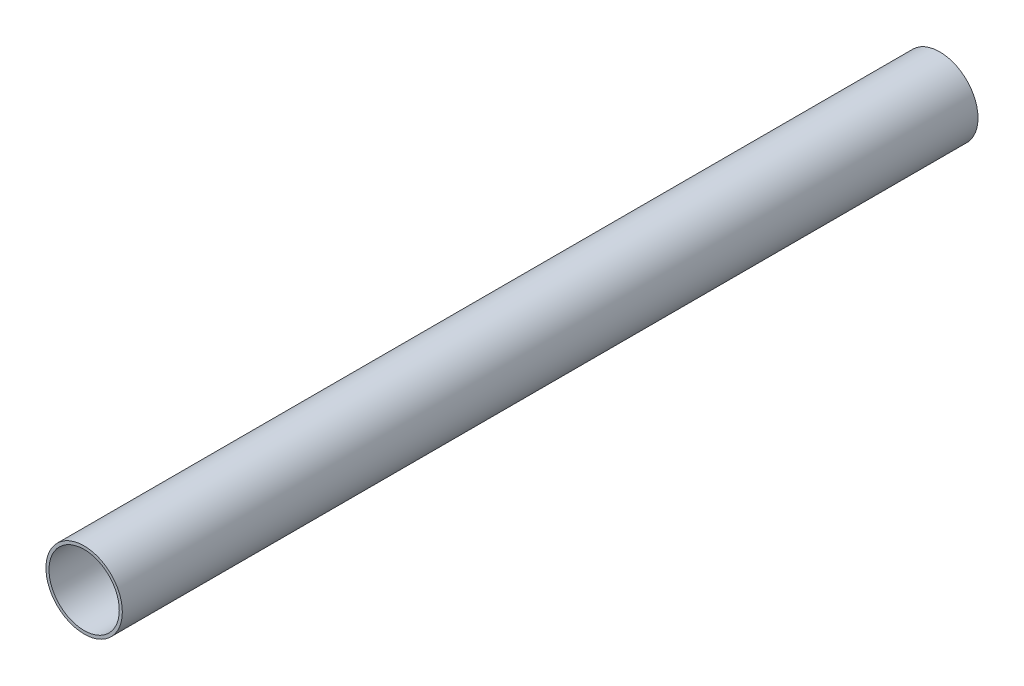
SolidWorks part; units mm, degrees
ref_plane "Plan de face" through (0, 0, 0) normal (0, 0, 1) x (1, 0, 0)
ref_plane "Plan de dessus" through (0, 0, 0) normal (0, 1, 0) x (1, 0, 0)
ref_plane "Plan de droite" through (0, 0, 0) normal (1, 0, 0) x (0, 0, -1)
sketch "Esquisse1" plane through (0, 0, 0) normal (0, 0, 1) x (1, 0, 0)
  circle A0 centre (0, 0) radius 11.5
  circle A1 centre (0, 0) radius 12.5
  dimension "D1" = 25
  dimension "D2" = 23
extrude "Extrusion1" add sketch "Esquisse1" along normal blind 280
